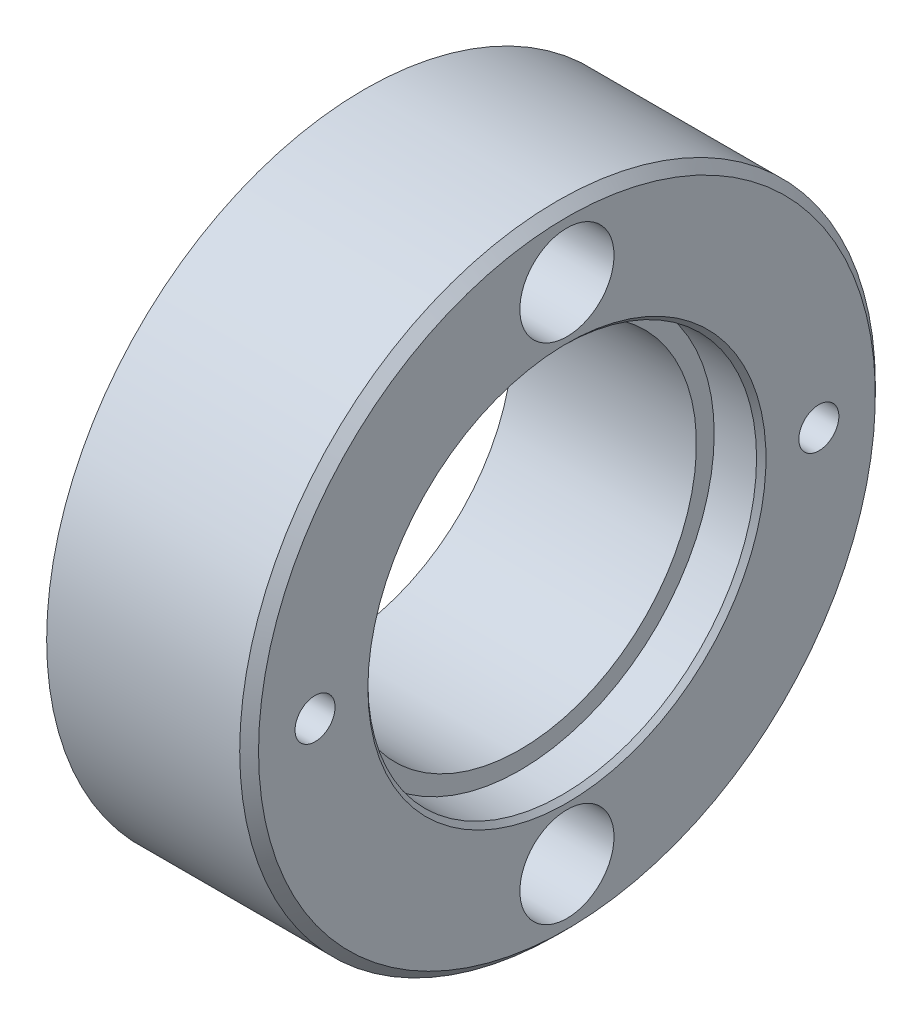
SolidWorks part; units mm, degrees
ref_plane "Face" through (0, 0, 0) normal (0, 0, 1) x (1, 0, 0)
ref_plane "Dessus" through (0, 0, 0) normal (0, 1, 0) x (1, 0, 0)
ref_plane "Droite" through (0, 0, 0) normal (1, 0, 0) x (0, 0, -1)
sketch "Esquisse1" plane through (0, 0, 0) normal (0, 0, 1) x (1, 0, 0)
  line L0 (0, 0) -> (62.0418, 0) construction
  line L1 (0, 37.5) -> (39, 37.5)
  line L2 (39, 37.5) -> (39, 41.275)
  line L3 (39, 41.275) -> (48, 41.275)
  line L4 (49, 42.275) -> (49, 65.5)
  line L5 (47, 67.5) -> (6, 67.5)
  line L6 (6, 67.5) -> (6, 41.275)
  line L7 (6, 41.275) -> (1, 41.275)
  line L8 (0, 40.275) -> (0, 37.5)
  line L9 (1, 41.275) -> (0, 40.275)
  line L10 (48, 41.275) -> (49, 42.275)
  line L11 (49, 65.5) -> (47, 67.5)
  point P7 (49, 41.275)
  point P8 (49, 67.5)
  point P11 (0, 41.275)
  dimension "D1" = 75
  dimension "D2" = 82.55
  dimension "D3" = 135
  dimension "D4" = 82.55
  dimension "D5" = 6
  dimension "D6" = 49
  dimension "D7" = 10
  dimension "D8" = 1
  dimension "D9" = 45
  dimension "D10" = 1
  dimension "D11" = 45
  dimension "D12" = 2
  dimension "D13" = 45
revolve "Révolution1" add sketch "Esquisse1" angle 360 about L0
sketch "Esquisse2" plane through (49, 0, 0) normal (1, 0, 0) x (0, 0, -1)
  line L0 (0, 0) -> (0, 84.8988) construction
  line L1 (0, 0) -> (0, -79.5927) construction
  line L2 (0, 0) -> (80.6981, 0) construction
  line L3 (0, 0) -> (-82.2457, 0) construction
hole_wizard "Trou taraudé M101" positions "Esquisse4" profile "Esquisse3" tap size "M10" standard "ISO"
sketch "Esquisse4" plane through (49, 0, 0) normal (1, 0, 0) x (0, 0, -1)
  line L0 (0, 0) -> (0, 84.8988) construction
  line L1 (0, 0) -> (-82.2457, 0) construction
  point P0 (-53.5, 0)
  dimension "D1" = 53.5
sketch "Esquisse3" plane through (49, 0, 53.5) normal (0, 1, 0) x (0, 0, -1)
  line L0 (0, 0) -> (0, 32.5537)
  line L1 (0, 32.5537) -> (4.25, 30)
  line L2 (4.25, 30) -> (4.25, 0)
  line L5 (4.25, 0) -> (0, 0)
  line L10 (0, 32.5537) -> (-4.25, 30) construction
  line L11 (0, -6.35) -> (0, 107.95) construction
  dimension "Diamètre du trou pour taraudage" = 8.5
  dimension "Profondeur du trou pour taraudage" = 30
  dimension "Angle de pointe" = 118
hole_wizard "Chambrage pour vis à tête hexagonale M101" positions "Esquisse6" profile "Esquisse5" counterbore size "M10" standard "ISO"
sketch "Esquisse6" plane through (49, 0, 0) normal (1, 0, 0) x (0, 0, -1)
  line L0 (0, 0) -> (80.6981, 0) construction
  line L1 (0, 0) -> (0, 84.8988) construction
  point P0 (0, 53.5)
  dimension "D1" = 53.5
sketch "Esquisse5" plane through (49, 53.5, 0) normal (0, 1, 0) x (0, 0, -1)
  line L0 (0, 0) -> (0, 49)
  line L1 (0, 49) -> (5.5, 49)
  line L3 (5.5, 49) -> (5.5, 20)
  line L4 (5.5, 20) -> (10, 20)
  line L5 (10, 20) -> (10, 0)
  line L7 (10, 0) -> (0, 0)
  line L11 (0, -6.35) -> (0, 107.95) construction
  dimension "Diamètre du perçage jusqu'au prochain" = 11
  dimension "Profondeur du perçage jusqu'au prochain" = 49
  dimension "Diamètre du chambrage" = 20
  dimension "Profondeur du chambrage" = 20
pattern_circular "Répétition circulaire1" count 2 every 180 about axis through (0, 0, 0) along (1, 0, 0) of "Trou taraudé M101", "Chambrage pour vis à tête hexagonale M101"
